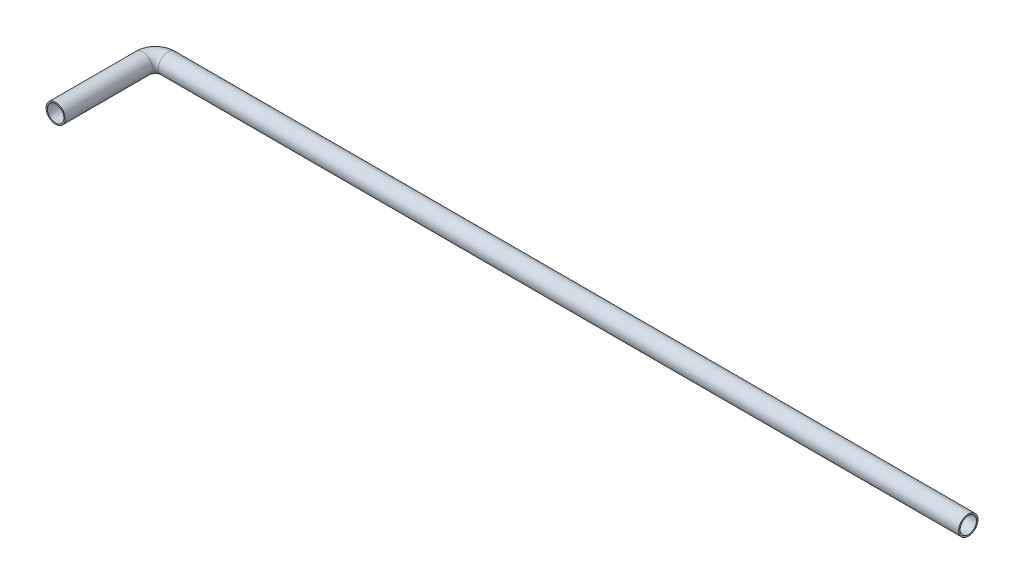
SolidWorks part; units mm, degrees
ref_plane "Front Plane" through (0, 0, 0) normal (0, 0, 1) x (1, 0, 0)
ref_plane "Top Plane" through (0, 0, 0) normal (0, 1, 0) x (1, 0, 0)
ref_plane "Right Plane" through (0, 0, 0) normal (1, 0, 0) x (0, 0, -1)
sketch "Schizzo1" plane through (0, 0, 0) normal (0, 0, 1) x (1, 0, 0)
  circle A0 centre (0, 0) radius 5.5
  circle A1 centre (0, 0) radius 4.75
  dimension "D1" = 11
  dimension "D2" = 9.5
extrude "Estrusione-Estrusione1" add sketch "Schizzo1" along normal blind 50
sketch "Schizzo2" plane through (0, 0, 0) normal (0, 0, -1) x (-1, 0, 0)
  line L0 (-7.2588, 7.0283) -> (-7.2588, -8.0363) construction
  circle A0 centre (0, 0) radius 4.75
  circle A1 centre (0, 0) radius 5.5
revolve "Rivoluzione2" add sketch "Schizzo2" angle 90 about L0
sketch "Schizzo3" plane through (7.2588, 0, 0) normal (1, 0, 0) x (0, 0, -1)
  circle A0 centre (7.2169, 0) radius 4.7082
  circle A1 centre (7.2169, 0) radius 5.5418
extrude "Estrusione-Estrusione2" add sketch "Schizzo3" along normal blind 459
